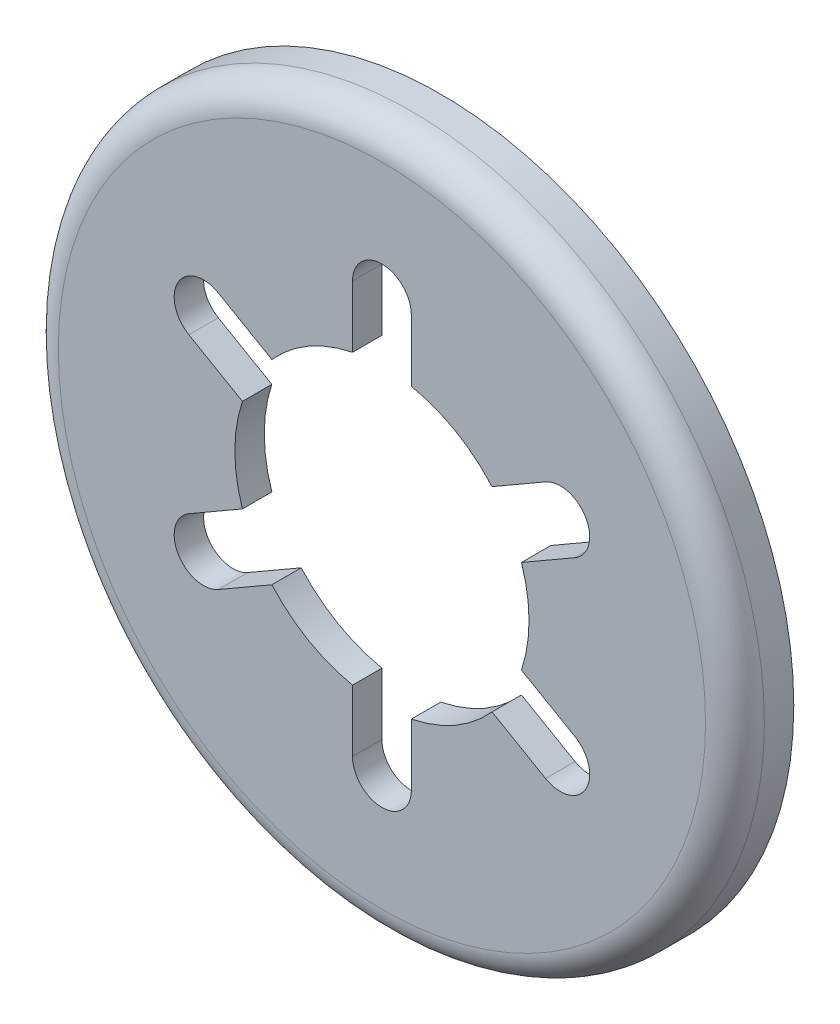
SolidWorks part; units mm, degrees
ref_plane "Plan de face" through (0, 0, 0) normal (0, 0, 1) x (1, 0, 0)
ref_plane "Plan de dessus" through (0, 0, 0) normal (0, 1, 0) x (1, 0, 0)
ref_plane "Plan de droite" through (0, 0, 0) normal (1, 0, 0) x (0, 0, -1)
sketch "Esquisse1" plane through (0, 0, 0) normal (0, 0, 1) x (1, 0, 0)
  circle A0 centre (0, 0) radius 2.5
  circle A1 centre (0, 0) radius 6
  dimension "D1" = 5
  dimension "D2" = 12
extrude "Extrusion1" add sketch "Esquisse1" along normal blind 1
sketch "Esquisse2" plane through (0, 0, 1) normal (0, 0, 1) x (1, 0, 0)
  line L0 (0, 0) -> (0, 6.6452) construction
  line L1 (0, 0) -> (6.6428, 3.8352) construction
  line L2 (0, 0) -> (0, -6.4094) construction
  line L3 (0, 0) -> (6.2165, -3.5891) construction
  line L4 (-0.5, 3.5) -> (-0.5, 2.4495)
  line L5 (0.5, 3.5) -> (0.5, 2.4495)
  line L6 (2.3713, 0.7917) -> (3.2811, 1.317)
  line L7 (1.8713, 1.6578) -> (2.7811, 2.183)
  line L8 (2.3713, -0.7917) -> (3.2811, -1.317)
  line L9 (1.8713, -1.6578) -> (2.7811, -2.183)
  line L10 (0, 0) -> (6.8914, 0) construction
  line L11 (0.5, -3.5) -> (0.5, -2.4495)
  line L12 (-0.5, -3.5) -> (-0.5, -2.4495)
  line L13 (-1.8713, -1.6578) -> (-2.7811, -2.183)
  line L14 (-2.3713, -0.7917) -> (-3.2811, -1.317)
  line L15 (-1.8713, 1.6578) -> (-2.7811, 2.183)
  line L16 (-2.3713, 0.7917) -> (-3.2811, 1.317)
  line L17 (0, 0) -> (-4.7778, -2.7585) construction
  line L18 (0, 0) -> (-5.1148, 2.953) construction
  circle A1 centre (0, 0) radius 2.5 construction
  arc A2 (0.5, 2.4495) -> (-0.5, 2.4495) centre (0, 0) ccw
  arc A3 (0.5, 3.5) -> (-0.5, 3.5) centre (0, 3.5) ccw
  arc A4 (3.2811, 1.317) -> (2.7811, 2.183) centre (3.0311, 1.75) ccw
  arc A5 (2.7811, -2.183) -> (3.2811, -1.317) centre (3.0311, -1.75) ccw
  arc A6 (-0.5, -3.5) -> (0.5, -3.5) centre (0, -3.5) ccw
  arc A7 (-2.7811, 2.183) -> (-3.2811, 1.317) centre (-3.0311, 1.75) ccw
  arc A8 (-3.2811, -1.317) -> (-2.7811, -2.183) centre (-3.0311, -1.75) ccw
  arc A9 (-1.8713, 1.6578) -> (-2.3713, 0.7917) centre (0, 0) ccw
  arc A10 (-2.3713, -0.7917) -> (-1.8713, -1.6578) centre (0, 0) ccw
  arc A11 (-0.5, -2.4495) -> (0.5, -2.4495) centre (0, 0) ccw
  arc A12 (1.8713, -1.6578) -> (2.3713, -0.7917) centre (0, 0) ccw
  arc A13 (2.3713, 0.7917) -> (1.8713, 1.6578) centre (0, 0) ccw
  dimension "D7" = 1
  dimension "D8" = 1
  dimension "D9" = 1
  dimension "D10" = 1
  dimension "D11" = 1
  dimension "D12" = 1
  dimension "D2" = 60
  dimension "D3" = 60
  dimension "D4" = 1
  dimension "D5" = 0.5
  dimension "D6" = 0.5
extrude "Enlèv. mat.-Extru.1" cut sketch "Esquisse2" against normal through all
sketch "Esquisse3" plane through (0, 0, 0) normal (0, 0, -1) x (-1, 0, 0)
  circle A0 centre (0, 0) radius 5.5
  dimension "D1" = 11
extrude "Enlèv. mat.-Extru.2" cut sketch "Esquisse3" against normal blind 0.5
fillet "Congé1" radius 0.5 2 edges at (-5.5, 0, 0.5) (6, 0, 1)
